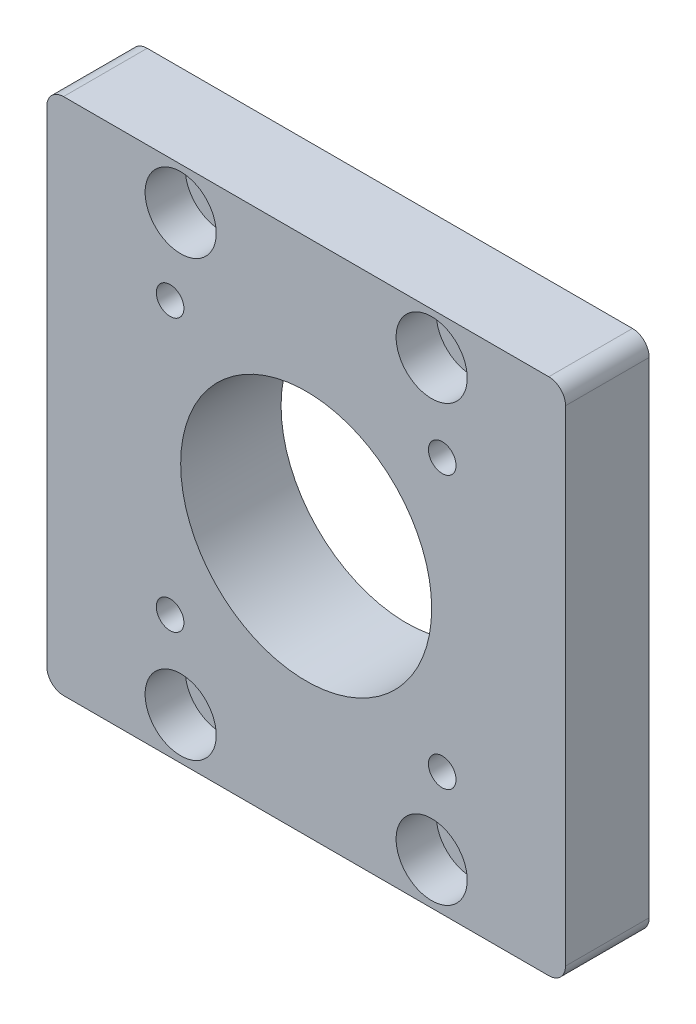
SolidWorks part; units mm, degrees
ref_plane "前视基准面" through (0, 0, 0) normal (0, 0, 1) x (1, 0, 0)
ref_plane "上视基准面" through (0, 0, 0) normal (0, 1, 0) x (1, 0, 0)
ref_plane "右视基准面" through (0, 0, 0) normal (1, 0, 0) x (0, 0, -1)
sketch "草图1" plane through (0, 0, 0) normal (0, 0, 1) x (1, 0, 0)
  line L1 (-31, -31) -> (31, -31)
  line L2 (-31, -31) -> (-31, 31)
  line L3 (-31, 31) -> (31, 31)
  line L4 (31, -31) -> (31, 31)
  line L5 (-31, -31) -> (31, 31) construction
  line L6 (-31, 31) -> (31, -31) construction
  circle A0 centre (0, 0) radius 15
  point P0 (0, 0)
  dimension "D3" = 30
  dimension "D1" = 62
  dimension "D2" = 62
extrude "凸台-拉伸1" add sketch "草图1" along normal blind 10
sketch "草图2" plane through (0, 0, 10) normal (0, 0, 1) x (1, 0, 0)
  line L0 (0, 31) -> (0, 0) construction
  line L1 (31, 31) -> (-31, 31) construction
  line L2 (0, 0) -> (-31, 0) construction
  line L3 (-31, 31) -> (-31, -31) construction
  line L4 (-16.2635, 16.2635) -> (16.2635, -16.2635) construction
  line L5 (16.2635, 16.2635) -> (-16.2635, -16.2635) construction
  circle A0 centre (-16.2635, 16.2635) radius 1.65
  circle A1 centre (16.2635, 16.2635) radius 1.65
  circle A2 centre (16.2635, -16.2635) radius 1.65
  circle A3 centre (-16.2635, -16.2635) radius 1.65
  circle A4 centre (0, 0) radius 23 construction
  dimension "D1" = 46
  dimension "D2" = 45
  dimension "D3" = 3.3
  dimension "D4" = 45
extrude "切除-拉伸1" cut sketch "草图2" against normal through all
sketch "草图5" plane through (0, 0, 10) normal (0, 0, 1) x (1, 0, 0)
  line L0 (0, 30) -> (0, 0) construction
  line L1 (0, 0) -> (-30, 0) construction
  line L2 (-15, 25.9808) -> (15, -25.9808) construction
  line L3 (15, 25.9808) -> (-15, -25.9808) construction
  circle A0 centre (0, 0) radius 30 construction
  circle A1 centre (-15, 25.9808) radius 2.25
  circle A2 centre (15, 25.9808) radius 2.25
  circle A3 centre (15, -25.9808) radius 2.25
  circle A4 centre (-15, -25.9808) radius 2.25
  dimension "D3" = 60
  dimension "D4" = 4.5
  dimension "D1" = 30
  dimension "D2" = 30
extrude "切除-拉伸3" cut sketch "草图5" against normal through all
sketch "草图6" plane through (0, 0, 10) normal (0, 0, 1) x (1, 0, 0)
  circle A0 centre (-15, 25.9808) radius 4.25
  circle A1 centre (15, 25.9808) radius 4.25
  circle A2 centre (15, -25.9808) radius 4.25
  circle A3 centre (-15, -25.9808) radius 4.25
  dimension "D1" = 8.5
extrude "切除-拉伸4" cut sketch "草图6" against normal blind 4.8
fillet "圆角1" radius 2 4 edges at (-31, 31, 5) (-31, -31, 5) (31, -31, 5) (31, 31, 5)
sketch "草图7" plane through (0, 0, 0) normal (0, 0, -1) x (-1, 0, 0)
  circle A0 centre (0, 0) radius 25
  circle A1 centre (0, 0) radius 15 construction
  circle A2 centre (0, 0) radius 15
  dimension "D1" = 50
extrude "凸台-拉伸2" add sketch "草图7" along normal blind 2
hole_wizard "M4 螺纹孔1" positions "草图9" profile "草图8" tap size "M4" standard "GB"
sketch "草图9" plane through (0, 0, 10) normal (0, 0, 1) x (1, 0, 0)
  point P0 (16.2635, 16.2635)
  point P3 (16.2635, -16.2635)
  point P6 (-16.2635, -16.2635)
  point P9 (-16.2635, 16.2635)
sketch "草图8" plane through (16.2635, 16.2635, 10) normal (1, 0, 0) x (0, -1, 0)
  line L0 (0, 0) -> (0, 14.3914)
  line L1 (0, 14.3914) -> (1.65, 13.4)
  line L2 (1.65, 13.4) -> (1.65, 0)
  line L5 (1.65, 0) -> (0, 0)
  line L10 (0, 14.3914) -> (-1.65, 13.4) construction
  line L11 (0, -6.35) -> (0, 107.95) construction
  dimension "螺纹孔钻头直径" = 3.3
  dimension "螺纹孔钻头深度" = 13.4
  dimension "导头角度" = 118
